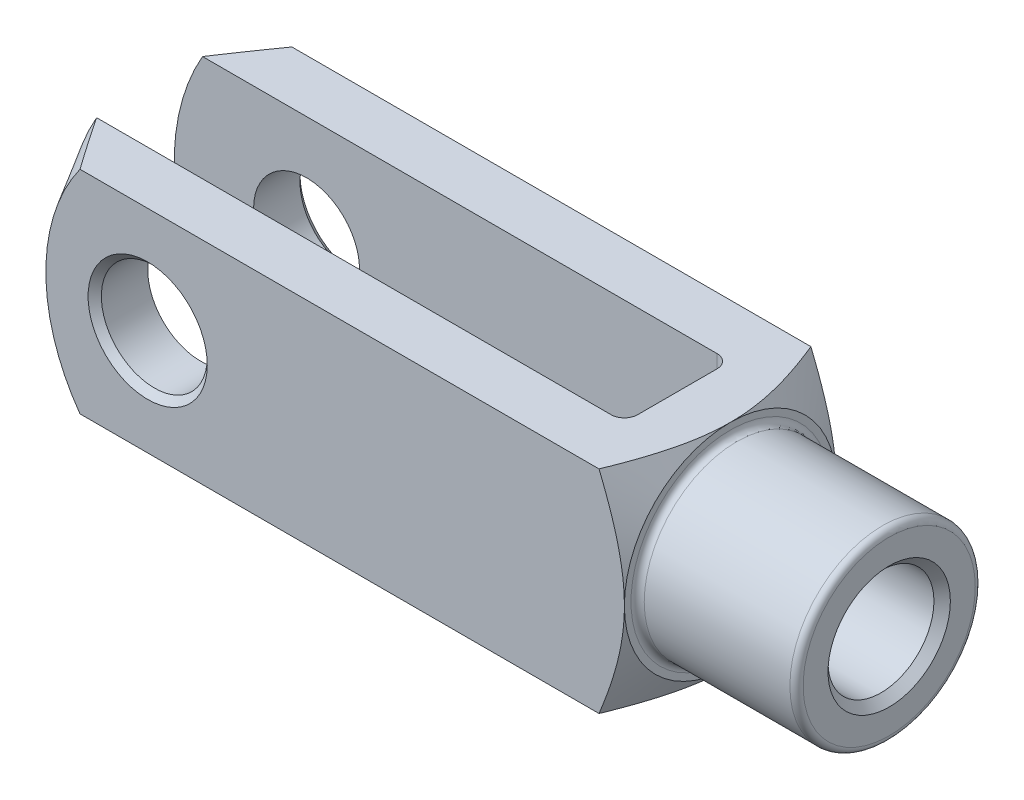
SolidWorks part; units mm, degrees
ref_plane "Front Plane" through (0, 0, 0) normal (0, 0, 1) x (1, 0, 0)
ref_plane "Top Plane" through (0, 0, 0) normal (0, 1, 0) x (1, 0, 0)
ref_plane "Right Plane" through (0, 0, 0) normal (1, 0, 0) x (0, 0, -1)
sketch "Sketch1" plane through (0, 0, 0) normal (1, 0, 0) x (0, 0, -1)
  line L0 (0, 0) -> (0, 50000) construction
  line L1 (0, 0) -> (50000, 0) construction
  line L2 (-8, -8) -> (-8, 8)
  line L3 (-8, 8) -> (8, 8)
  line L4 (8, -8) -> (8, 8)
  line L5 (-8, -8) -> (8, -8)
  point P9 (0, 8)
  point P11 (8, 0)
  point P12 (-8, 0)
  dimension "D1" = 16
  dimension "D2" = 16
extrude "Extrude1" add sketch "Sketch1" against normal blind 58
sketch "Sketch2" plane through (0, 0, 0) normal (1, 0, 0) x (0, 0, -1)
  circle A0 centre (0, 0) radius 7
  circle A1 centre (0, 0) radius 14
  dimension "D1" = 14
  dimension "D2" = 28
extrude "Extrude2" cut sketch "Sketch2" against normal blind 12
sketch "Sketch3" plane through (0, 0, 8) normal (0, 0, 1) x (1, 0, 0)
  circle A0 centre (-48, 0) radius 4
  dimension "D1" = 8
  dimension "D2" = 48
extrude "Extrude3" cut sketch "Sketch3" against normal through all
sketch "Sketch4" plane through (0, 8, 0) normal (0, 1, 0) x (1, 0, 0)
  line L0 (0, 0) -> (-50000, 0) construction
  line L1 (-58, -4) -> (-58, 4)
  line L2 (-58, 8) -> (-58, -8) construction
  line L3 (-58, 4) -> (-16, 4)
  line L4 (-16, 4) -> (-16, -4)
  line L5 (-48, 8) -> (-48, -8) construction
  line L6 (-58, -4) -> (-16, -4)
  point P7 (-48, 0)
  point P13 (-16, 0)
  point P14 (-58, 0)
  dimension "D1" = 32
  dimension "D2" = 8
extrude "Extrude4" cut sketch "Sketch4" against normal through all
fillet "Fillet1" radius 1 2 edges at (-16, 0, 4) (-16, 0, -4)
fillet "Fillet2" radius 0.5 2 edges at (0, 0, -7) (-12, 0, -7)
chamfer "Chamfer2" distance 0.5 angle 45 2 edges at (-44, 0, -8) (-44, 0, 8)
sketch "Sketch6" plane through (0, 0, 0) normal (0, 0, 1) x (1, 0, 0)
  line L0 (-12, -8) -> (-12, -16)
  line L1 (-12, -16) -> (-16.6188, -16)
  line L2 (-16.6188, -16) -> (-12, -8)
  dimension "D1" = 30
  dimension "D2" = 16
revolve "Cut-Revolve1" cut sketch "Sketch6" angle 360 about axis through (-12, 0, 0) along (1, 0, 0)
sketch "Sketch7" plane through (0, 0, 0) normal (0, 1, 0) x (1, 0, 0)
  line L0 (-55.6906, -8) -> (-58, -4)
  line L1 (-58, 4) -> (-55.6906, 8)
  line L2 (-55.6906, 8) -> (-74, 8)
  line L3 (-58, 4) -> (-58, -4)
  line L4 (-74, 8) -> (-74, -8)
  line L5 (-74, -8) -> (-55.6906, -8)
  line L6 (-58, 8) -> (-13.9132, 8) construction
  line L7 (-58, -8) -> (-13.9132, -8) construction
  line L8 (-42, 0.6162) -> (-42, 50000.6162) construction
  dimension "D1" = 120
  dimension "D2" = 16
  dimension "D3" = 16
revolve "Cut-Revolve2" cut sketch "Sketch7" angle 180 about L8
sketch "Sketch8" plane through (0, 0, 0) normal (1, 0, 0) x (0, 0, -1)
  circle A0 centre (0, 0) radius 4
  dimension "D1" = 8
extrude "Extrude5" cut sketch "Sketch8" against normal through all
chamfer "Chamfer3" distance 0.62 angle 45 1 edges at (0, 0, -4)
equation "\"D2@Sketch1\" = \"D1@Sketch1\""
equation "\"D2@Sketch2\" = \"D1@Sketch2\"*2"
equation "\"D2@Sketch6\" = \"D1@Sketch1\""
equation "\"D2@Sketch7\" = \"D1@Sketch1\""
equation "\"D3@Sketch7\" = \"D1@Sketch1\""
